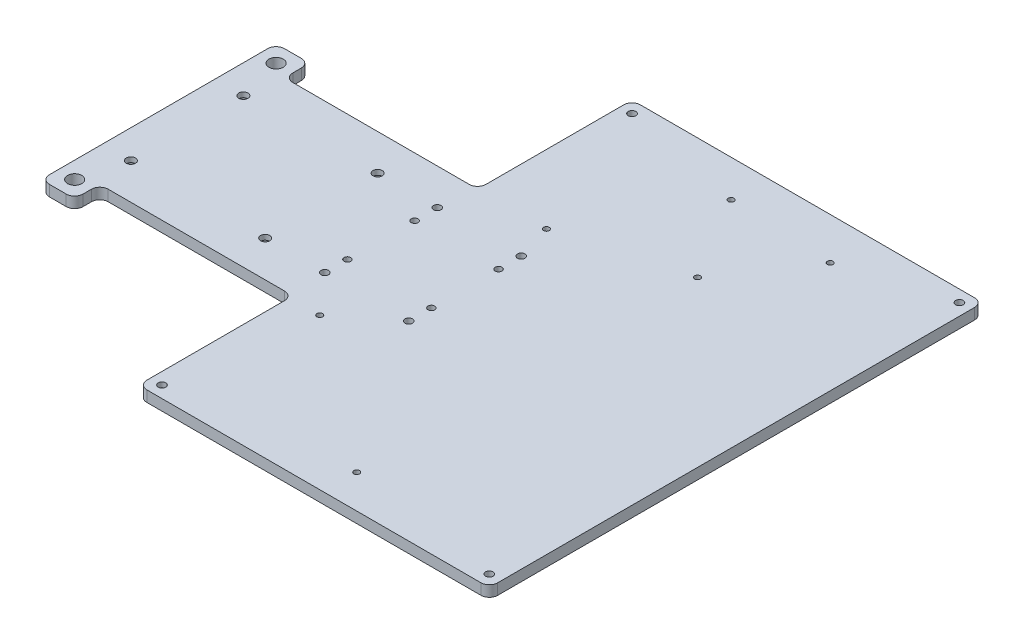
SolidWorks part; units mm, degrees
ref_plane "Front" through (0, 0, 0) normal (0, 0, 1) x (1, 0, 0)
ref_plane "Top" through (0, 0, 0) normal (0, 1, 0) x (1, 0, 0)
ref_plane "Right" through (0, 0, 0) normal (1, 0, 0) x (0, 0, -1)
sketch "Esquisse1" plane through (0, 0, 0) normal (0, 1, 0) x (1, 0, 0)
  line L0 (0, 33.5) -> (0, -33.5) construction
  line L1 (-132.5, 0) -> (211.5, 0) construction
  line L2 (-35.5, 33.5) -> (50, 33.5) construction
  line L3 (-115.5, 33.5) -> (-35.5, 33.5) construction
  line L4 (-115.5, 33.5) -> (-115.5, -33.5) construction
  line L5 (-115.5, -33.5) -> (-35.5, -33.5) construction
  line L6 (-35.5, 33.5) -> (-35.5, -33.5) construction
  line L8 (-132.5, 70) -> (-132.5, -70)
  line L11 (-35.5, -33.5) -> (50, -33.5) construction
  line L12 (50, 147) -> (50, -147) construction
  line L13 (0, 20) -> (50, 20) construction
  line L14 (0, -20) -> (50, -20) construction
  line L21 (211.5, -147) -> (211.5, 147)
  line L22 (211.5, -147) -> (2.5, -147)
  line L24 (2.5, 147) -> (211.5, 147)
  line L25 (9.5, 140) -> (9.5, -140) construction
  line L26 (204.5, -140) -> (9.5, -140) construction
  line L27 (204.5, -140) -> (204.5, 140) construction
  line L28 (9.5, 140) -> (204.5, 140) construction
  line L29 (-112.5, 55) -> (2.5, 55)
  line L30 (2.5, 55) -> (2.5, 147)
  line L31 (-112.5, -55) -> (2.5, -55)
  line L32 (-132.5, 70) -> (-112.5, 70)
  line L33 (-112.5, 70) -> (-112.5, 55)
  line L34 (2.5, -55) -> (2.5, -147)
  line L35 (-132.5, -70) -> (-112.5, -70)
  line L36 (-112.5, -55) -> (-112.5, -70)
  line L37 (-122.5, 70) -> (-122.5, -70) construction
  point P11 (-132.5, 117)
  point P13 (-132.5, -157)
  point P35 (-122.5, 60)
  point P36 (-122.5, -60)
  dimension "D1" = 67
  dimension "D2" = 80
  dimension "D3" = 35.5
  dimension "D4" = 17
  dimension "D5" = 147
  dimension "D6" = 344
  dimension "D7" = 40
  dimension "D8" = 50
  dimension "D9" = 147
  dimension "D10" = 209
  dimension "D11" = 7
  dimension "D12" = 7
  dimension "D13" = 7
  dimension "D14" = 20
  dimension "D15" = 7
  dimension "D16" = 140
  dimension "D17" = 120
extrude "Boss.-Extru.1" add sketch "Esquisse1" along normal blind 6.5
hole_wizard "Diamètre du perçage Ø8.5 (8.5)1" positions "Esquisse15" profile "Esquisse16" hole size "Ø8.5" standard "ISO"
sketch "Esquisse15" plane through (0, 6.5, 0) normal (0, 1, 0) x (1, 0, 0)
  point P0 (-122.5, 60)
  point P3 (-122.5, -60)
sketch "Esquisse16" plane through (-122.5, 6.5, -60) normal (1, 0, 0) x (0, 0, 1)
  line L0 (0, 0) -> (0, 6.5)
  line L1 (0, 6.5) -> (4.25, 6.5)
  line L2 (4.25, 6.5) -> (4.25, 0)
  line L5 (4.25, 0) -> (0, 0)
  line L11 (0, -6.35) -> (0, 107.95) construction
  dimension "Diamètre du perçage jusqu'au prochain" = 8.5
  dimension "Profondeur du perçage jusqu'au prochain" = 6.5
hole_wizard "Chambrage pour vis à tête hexagonale M51" positions "Esquisse6" profile "Esquisse7" counterbore size "M5" standard "ISO"
sketch "Esquisse6" plane through (0, 0, 0) normal (0, -1, 0) x (-1, 0, 0)
  point P0 (115.5, -33.5)
  point P3 (35.5, -33.5)
  point P6 (35.5, 33.5)
  point P9 (115.5, 33.5)
sketch "Esquisse7" plane through (-115.5, 0, 33.5) normal (1, 0, 0) x (0, 0, -1)
  line L0 (0, 0) -> (0, 6.5)
  line L1 (0, 6.5) -> (2.75, 6.5)
  line L3 (2.75, 6.5) -> (2.75, 3.5)
  line L4 (2.75, 3.5) -> (5, 3.5)
  line L5 (5, 3.5) -> (5, 0)
  line L7 (5, 0) -> (0, 0)
  line L11 (0, -6.35) -> (0, 107.95) construction
  dimension "Diamètre du perçage jusqu'au prochain" = 5.5
  dimension "Profondeur du perçage jusqu'au prochain" = 6.5
  dimension "Diamètre du chambrage" = 10
  dimension "Profondeur du chambrage" = 3.5
hole_wizard "Diamètre du perçage Ø4.0 (4)1" positions "Esquisse8" profile "Esquisse9" hole size "Ø4.0" standard "ISO"
sketch "Esquisse8" plane through (0, 0, 0) normal (0, -1, 0) x (-1, 0, 0)
  point P0 (0, -20)
  point P3 (0, 20)
  point P6 (-50, -20)
  point P9 (-50, 20)
sketch "Esquisse9" plane through (0, 0, 20) normal (1, 0, 0) x (0, 0, -1)
  line L0 (0, 0) -> (0, 6.5)
  line L1 (0, 6.5) -> (2, 6.5)
  line L2 (2, 6.5) -> (2, 0)
  line L5 (2, 0) -> (0, 0)
  line L11 (0, -6.35) -> (0, 107.95) construction
  dimension "Diamètre du perçage jusqu'au prochain" = 4
  dimension "Profondeur du perçage jusqu'au prochain" = 6.5
hole_wizard "Chambrage pour vis à tête hexagonale M41" positions "Esquisse10" profile "Esquisse11" counterbore size "M4" standard "ISO"
sketch "Esquisse10" plane through (0, 0, 0) normal (0, -1, 0) x (-1, 0, 0)
  line L0 (0, 33.5) -> (0, -33.5) construction
  line L1 (35.5, -33.5) -> (-50, -33.5) construction
  line L2 (35.5, 33.5) -> (-50, 33.5) construction
  point P0 (-50, -33.5)
  point P3 (-50, 33.5)
  point P7 (0, -33.5)
  point P13 (0, 33.5)
  point P17 (-204.5, -140)
  point P20 (-9.5, -140)
  point P23 (-9.5, 140)
  point P26 (-204.5, 140)
sketch "Esquisse11" plane through (50, 0, 33.5) normal (1, 0, 0) x (0, 0, -1)
  line L0 (0, 0) -> (0, 6.5)
  line L1 (0, 6.5) -> (2.25, 6.5)
  line L3 (2.25, 6.5) -> (2.25, 3.5)
  line L4 (2.25, 3.5) -> (4, 3.5)
  line L5 (4, 3.5) -> (4, 0)
  line L7 (4, 0) -> (0, 0)
  line L11 (0, -6.35) -> (0, 107.95) construction
  dimension "Diamètre du perçage jusqu'au prochain" = 4.5
  dimension "Profondeur du perçage jusqu'au prochain" = 6.5
  dimension "Diamètre du chambrage" = 8
  dimension "Profondeur du chambrage" = 3.5
fillet "Congé1" radius 5 12 edges at (211.5, 3.25, -147) (211.5, 3.25, 147) (2.5, 3.25, 55) (2.5, 3.25, 147) (2.5, 3.25, -55) (2.5, 3.25, -147) (-112.5, 3.25, -55) (-112.5, 3.25, 55) (-112.5, 3.25, -70) (-132.5, 3.25, -70) (-132.5, 3.25, 70) (-112.5, 3.25, 70)
sketch "Esquisse12" plane through (0, 6.5, 0) normal (0, 1, 0) x (1, 0, 0)
  line L0 (7.5, -147) -> (206.5, -147) construction
  line L1 (20.5, -57) -> (112.5, -57) construction
  line L2 (20.5, -57) -> (20.5, -127) construction
  line L3 (20.5, -127) -> (112.5, -127) construction
  line L4 (112.5, -57) -> (112.5, -127) construction
  line L5 (2.5, -60) -> (2.5, -142) construction
  line L6 (206.5, 147) -> (7.5, 147) construction
  line L7 (113.5, 122) -> (145.5, 122) construction
  line L8 (113.5, 122) -> (113.5, 75) construction
  line L9 (113.5, 75) -> (145.5, 75) construction
  line L10 (145.5, 122) -> (145.5, 75) construction
  line L11 (211.5, -142) -> (211.5, 142) construction
  line L13 (43.5, 125) -> (83.5, 125) construction
  line L14 (43.5, 125) -> (43.5, 55) construction
  line L15 (43.5, 55) -> (83.5, 55) construction
  line L16 (83.5, 125) -> (83.5, 55) construction
  dimension "D1" = 92
  dimension "D2" = 70
  dimension "D3" = 20
  dimension "D4" = 110
  dimension "D5" = 32
  dimension "D6" = 47
  dimension "D7" = 25
  dimension "D8" = 66
  dimension "D9" = 70
  dimension "D10" = 40
  dimension "D11" = 30
  dimension "D12" = 20
hole_wizard "Chambrage pour vis à tête hexagonale M31" positions "Esquisse13" profile "Esquisse14" counterbore size "M3" standard "ISO"
sketch "Esquisse13" plane through (0, 0, 0) normal (0, -1, 0) x (-1, 0, 0)
  point P0 (-112.5, -127)
  point P3 (-20.5, -57)
  point P6 (-145.5, 122)
  point P9 (-113.5, 75)
  point P12 (-43.5, 55)
  point P15 (-83.5, 125)
sketch "Esquisse14" plane through (112.5, 0, 127) normal (1, 0, 0) x (0, 0, -1)
  line L0 (0, 0) -> (0, 6.5)
  line L1 (0, 6.5) -> (1.7, 6.5)
  line L3 (1.7, 6.5) -> (1.7, 3.5)
  line L4 (1.7, 3.5) -> (3.25, 3.5)
  line L5 (3.25, 3.5) -> (3.25, 0)
  line L7 (3.25, 0) -> (0, 0)
  line L11 (0, -6.35) -> (0, 107.95) construction
  dimension "Diamètre du perçage jusqu'au prochain" = 3.4
  dimension "Profondeur du perçage jusqu'au prochain" = 6.5
  dimension "Diamètre du chambrage" = 6.5
  dimension "Profondeur du chambrage" = 3.5
